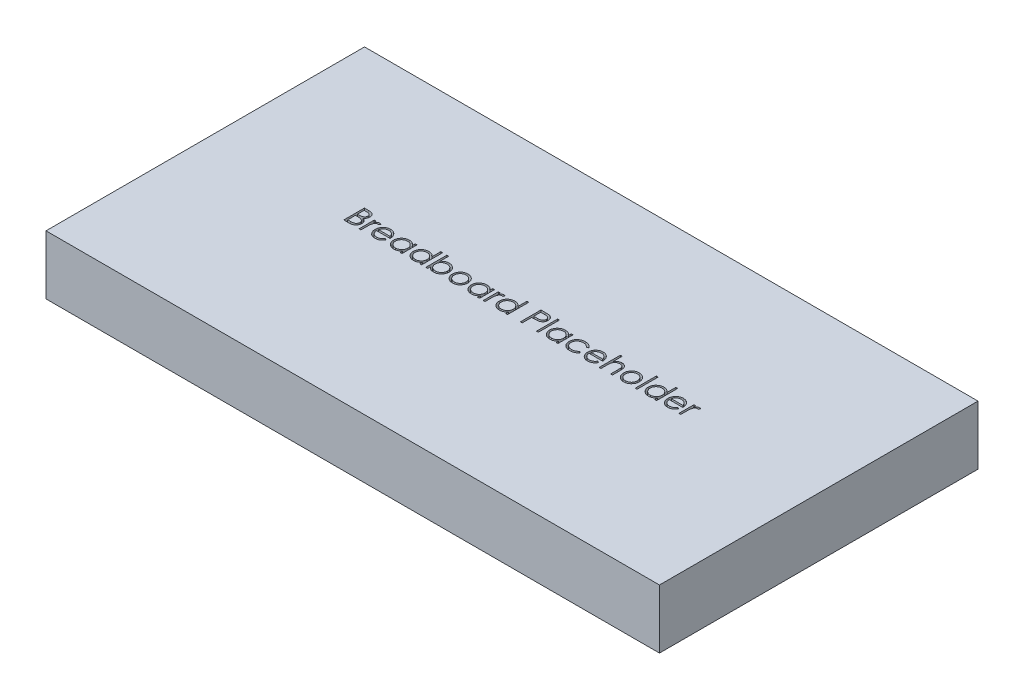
SolidWorks part; units mm, degrees
ref_plane "Front Plane" through (0, 0, 0) normal (0, 0, 1) x (1, 0, 0)
ref_plane "Top Plane" through (0, 0, 0) normal (0, 1, 0) x (1, 0, 0)
ref_plane "Right Plane" through (0, 0, 0) normal (1, 0, 0) x (0, 0, -1)
sketch "Sketch1" plane through (0, 0, 0) normal (0, 1, 0) x (1, 0, 0)
  line L1 (52, -27) -> (-52, -27)
  line L2 (52, -27) -> (52, 27)
  line L3 (52, 27) -> (-52, 27)
  line L4 (-52, -27) -> (-52, 27)
  line L5 (52, -27) -> (-52, 27) construction
  line L6 (52, 27) -> (-52, -27) construction
  point P0 (0, 0)
  dimension "D1" = 104
  dimension "D2" = 54
extrude "Boss-Extrude1" add sketch "Sketch1" along normal blind 10
sketch "Sketch2" plane through (0, 10, 0) normal (0, 1, 0) x (1, 0, 0)
  text T0 "Breadboard Placeholder"
extrude "Cut-Extrude1" cut sketch "Sketch2" against normal blind 2
